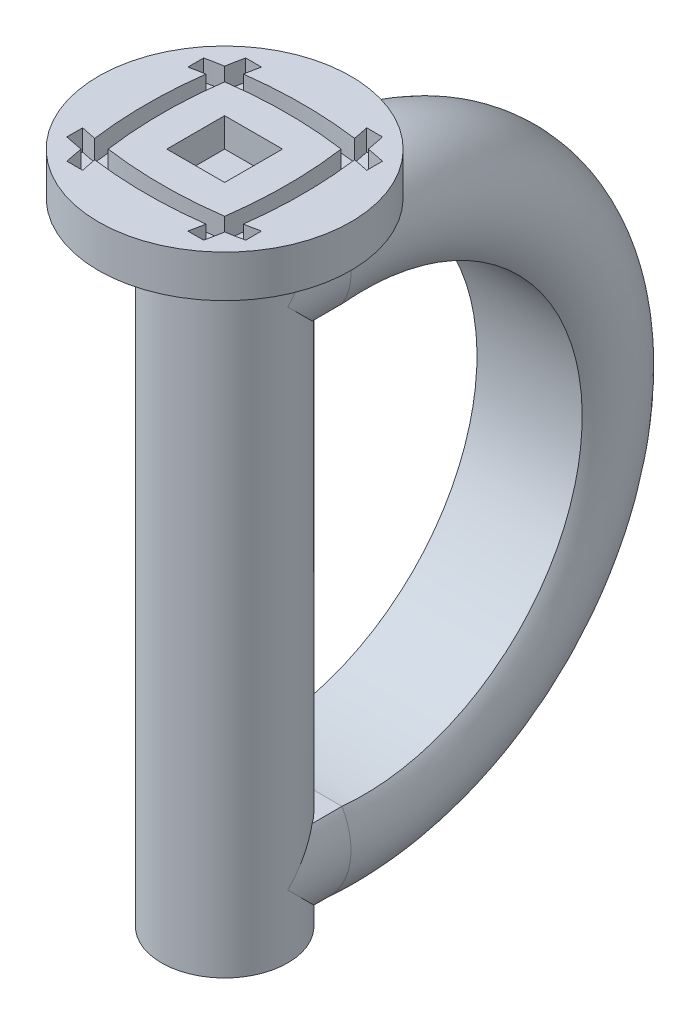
SolidWorks part; units mm, degrees
ref_plane "Front Plane" through (0, 0, 0) normal (0, 0, 1) x (1, 0, 0)
ref_plane "Top Plane" through (0, 0, 0) normal (0, 1, 0) x (1, 0, 0)
ref_plane "Right Plane" through (0, 0, 0) normal (1, 0, 0) x (0, 0, -1)
sketch "Sketch1" plane through (0, 0, 0) normal (0, 1, 0) x (1, 0, 0)
  circle A0 centre (0, 0) radius 24
  dimension "D1" = 48
extrude "Boss-Extrude1" add sketch "Sketch1" along normal blind 8
sketch "Sketch3" plane through (0, 8, 0) normal (0, 1, 0) x (1, 0, 0)
  line L0 (-5.5, 5.5) -> (5.5, 5.5)
  line L1 (5.5, 5.5) -> (5.5, -5.5)
  line L2 (5.5, -5.5) -> (-5.5, -5.5)
  line L3 (-5.5, -5.5) -> (-5.5, 5.5)
  dimension "D1" = 11
  dimension "D2" = 5.5
  dimension "D3" = 11
  dimension "D4" = 5.5
extrude "Cut-Extrude2" cut sketch "Sketch3" against normal blind 5.5
sketch "Sketch10" plane through (0, 8, 0) normal (0, 1, 0) x (1, 0, 0)
  line L1 (-17, 13) -> (-17, 10)
  line L3 (17, 10) -> (17, 13)
  line L4 (10, -17) -> (13, -17)
  line L5 (13, 17) -> (10, 17)
  line L7 (-17, -10) -> (-17, -13)
  line L8 (17, -13) -> (17, -10)
  line L10 (-10, 17) -> (-13, 17)
  line L11 (-13, -17) -> (-10, -17)
  arc A0 (-17, 13) -> (-13.6534, 13.6534) centre (0, -65.1729) cw
  arc A1 (-17, 10) -> (-14.125, 10.5759) centre (0, -67.4053) cw
  arc A2 (10, 17) -> (10.5759, 14.125) centre (-67.4053, 0) cw
  arc A3 (13, 17) -> (13.6534, 13.6534) centre (-65.1729, 0) cw
  arc A4 (17, -10) -> (14.125, -10.5759) centre (0, 67.4053) cw
  arc A5 (17, -13) -> (13.6534, -13.6534) centre (0, 65.1729) cw
  arc A6 (-10, -17) -> (-10.5759, -14.125) centre (67.4053, 0) cw
  arc A7 (-13, -17) -> (-13.6534, -13.6534) centre (65.1729, 0) cw
  arc A8 (-10.5759, 14.125) -> (-10, 17) centre (67.4053, 0) cw
  arc A9 (-13.6534, 13.6534) -> (-13, 17) centre (65.1729, 0) cw
  arc A10 (-11.0681, 11.0681) -> (11.0681, 11.0681) centre (0, -67.4053) cw
  arc A11 (-10.5759, 14.125) -> (10.5759, 14.125) centre (0, -65.1729) cw
  arc A12 (13.6534, 13.6534) -> (17, 13) centre (0, -65.1729) cw
  arc A13 (14.125, 10.5759) -> (17, 10) centre (0, -67.4053) cw
  arc A14 (11.0681, 11.0681) -> (11.0681, -11.0681) centre (-67.4053, 0) cw
  arc A15 (14.125, 10.5759) -> (14.125, -10.5759) centre (-65.1729, 0) cw
  arc A16 (13.6534, -13.6534) -> (13, -17) centre (-65.1729, 0) cw
  arc A17 (10.5759, -14.125) -> (10, -17) centre (-67.4053, 0) cw
  arc A18 (11.0681, -11.0681) -> (-11.0681, -11.0681) centre (0, 67.4053) cw
  arc A19 (10.5759, -14.125) -> (-10.5759, -14.125) centre (0, 65.1729) cw
  arc A20 (-13.6534, -13.6534) -> (-17, -13) centre (0, 65.1729) cw
  arc A21 (-14.125, -10.5759) -> (-14.125, 10.5759) centre (65.1729, 0) cw
  arc A22 (-14.125, -10.5759) -> (-17, -10) centre (0, 67.4053) cw
  arc A23 (-11.0681, -11.0681) -> (-11.0681, 11.0681) centre (67.4053, 0) cw
  point P36 (0, 0)
extrude "Cut-Extrude6" cut sketch "Sketch10" against normal blind 4
sketch "Sketch12" plane through (0, 0, 0) normal (0, 0, 1) x (1, 0, 0)
  line L0 (0, 0) -> (0, -120)
  line L1 (0, -120) -> (12, -120)
  line L2 (12, -120) -> (12, 0)
  line L3 (-24, 0) -> (24, 0) construction
  line L4 (12, 0) -> (0, 0)
  line L5 (0, 0) -> (0.3914, 0.2819)
  dimension "D1" = 12
  dimension "D2" = 120
revolve "Revolve4" add sketch "Sketch12" angle 360 about L0
sketch "Sketch13" plane through (0, 0, 0) normal (0, 0, 1) x (1, 0, 0)
  line L0 (-10, -18.6332) -> (10, -18.6332)
  arc A0 (10, -18.6332) -> (-10, -18.6332) centre (0, -12) ccw
  dimension "D1" = 24
  dimension "D2" = 20
sketch "Sketch14" plane through (0, 0, 0) normal (1, 0, 0) x (0, 0, -1)
  line L2 (0, -108) -> (12, -108)
  line L3 (0, -12) -> (12, -12)
  arc A0 (12, -108) -> (12, -12) centre (16.4021, -60) ccw
  dimension "D2" = 12
  dimension "D3" = 12
sweep "Sweep1" add profiles "Sketch13" path "Sketch14"
equation "\"D2@Sketch10\"=\"D1@Sketch10\"/2"
